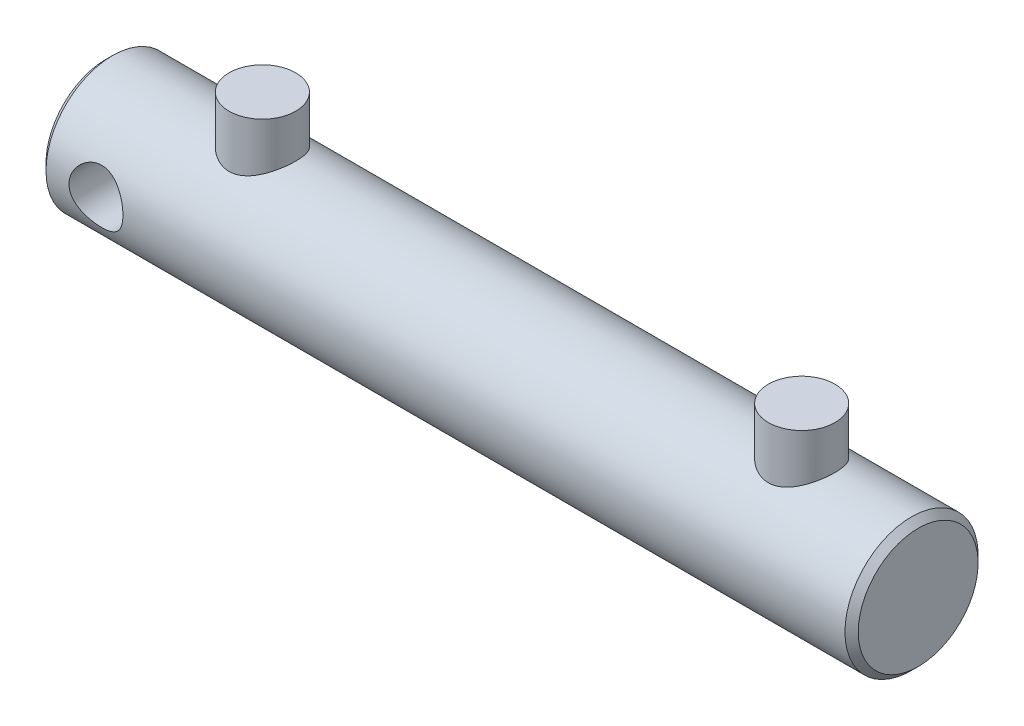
SolidWorks part; units mm, degrees
ref_plane "Plan de face" through (0, 0, 0) normal (0, 0, 1) x (1, 0, 0)
ref_plane "Plan de dessus" through (0, 0, 0) normal (0, 1, 0) x (1, 0, 0)
ref_plane "Plan de droite" through (0, 0, 0) normal (1, 0, 0) x (0, 0, -1)
sketch "Esquisse1" plane through (0, 0, 0) normal (0, 0, 1) x (1, 0, 0)
  line L0 (-122, 0) -> (122, 0) construction
  line L1 (-122, 0) -> (-122, 20)
  line L2 (-122, 20) -> (122, 20)
  line L3 (122, 20) -> (122, 0)
  line L6 (-122, 0) -> (122, 0)
  dimension "D1" = 40
  dimension "D3" = 244
revolve "Révolution1" add sketch "Esquisse1" angle 360 about L0
chamfer "Chanfrein1" distance 2 angle 45 2 edges at (122, 0, 20) (-122, 0, 20)
sketch "Esquisse3" plane through (0, 0, 0) normal (0, 0, 1) x (1, 0, 0)
  line L0 (-122, 18) -> (-122, -18) construction
  circle A0 centre (-105, 0) radius 8.1
  dimension "D1" = 16.2
  dimension "D2" = 17
extrude "Enlèv. mat.-Extru.1" cut sketch "Esquisse3" against normal through all and the other way through all
sketch "Esquisse5" plane through (0, 0, 0) normal (0, 1, 0) x (1, 0, 0)
  line L0 (-122, 18) -> (-122, -18) construction
  line L1 (122, -18) -> (122, 18) construction
  circle A0 centre (-75, 0) radius 10
  circle A1 centre (87, 0) radius 10
  dimension "D1" = 20
  dimension "D2" = 47
  dimension "D3" = 35
extrude "Extrusion2" add sketch "Esquisse5" along normal blind 33
